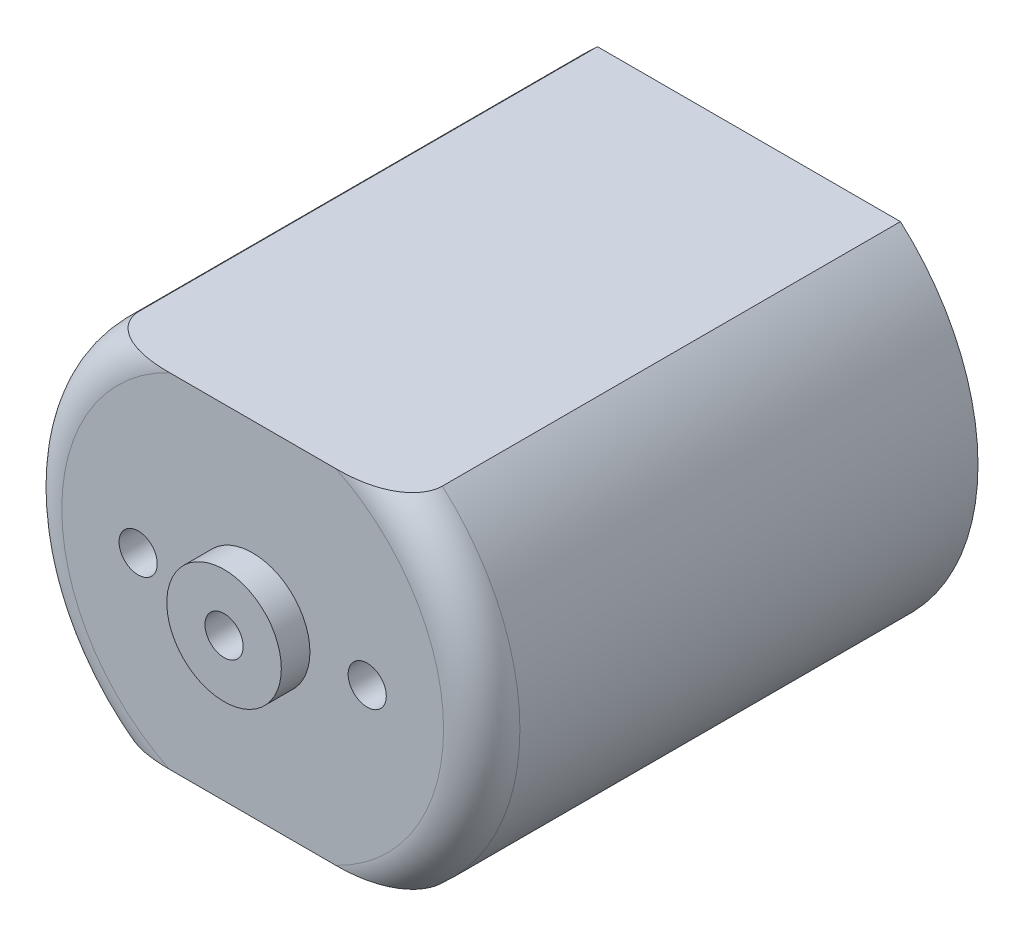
SolidWorks part; units mm, degrees
ref_plane "Face" through (0, 0, 0) normal (0, 0, 1) x (1, 0, 0)
ref_plane "Dessus" through (0, 0, 0) normal (0, 1, 0) x (1, 0, 0)
ref_plane "Droite" through (0, 0, 0) normal (1, 0, 0) x (0, 0, -1)
sketch "Esquisse1" plane through (0, 0, 0) normal (0, 0, 1) x (1, 0, 0)
  circle A0 centre (0, 0) radius 12
  dimension "D1" = 24
extrude "Cylindre de base" add sketch "Esquisse1" along normal mid plane 26
fillet "Congé1" radius 2
sketch "Esquisse2" plane through (0, 0, -13) normal (0, 0, -1) x (-1, 0, 0)
  line L0 (12, 0) -> (0, 0) construction
  line L1 (-12, 9) -> (12, 9)
  line L2 (-12, 9) -> (-12, -9)
  line L3 (-12, -9) -> (12, -9)
  line L4 (12, 9) -> (12, -9)
  line L5 (0, 9) -> (0, 0) construction
  circle A1 centre (0, 0) radius 12 construction
  dimension "D1" = 18
extrude "Méplats" cut sketch "Esquisse2" against normal through all flip side to cut
sketch "Esquisse3" plane through (0, 0, 13) normal (0, 0, 1) x (1, 0, 0)
  circle A0 centre (0, 0) radius 3
  dimension "D1" = 6
extrude "Bossage avant" add sketch "Esquisse3" along normal blind 1.5
sketch "Esquisse4" plane through (0, 0, 14.5) normal (0, 0, 1) x (1, 0, 0)
  circle A0 centre (0, 0) radius 1
  dimension "D1" = 2
extrude "Trou arbre" cut sketch "Esquisse4" against normal blind 3
sketch "Esquisse5" plane through (0, 0, -13) normal (0, 0, -1) x (-1, 0, 0)
  circle A0 centre (0, 0) radius 3
  dimension "D1" = 6
extrude "Bossage arrière" add sketch "Esquisse5" along normal blind 3
sketch "Esquisse6" plane through (0, 0, 13) normal (0, 0, 1) x (1, 0, 0)
  circle A0 centre (6, 0) radius 1
  dimension "D1" = 2
  dimension "D2" = 6
extrude "Trou fixation" cut sketch "Esquisse6" against normal blind 3
pattern_circular "Répétition fixation" count 2 over 360
